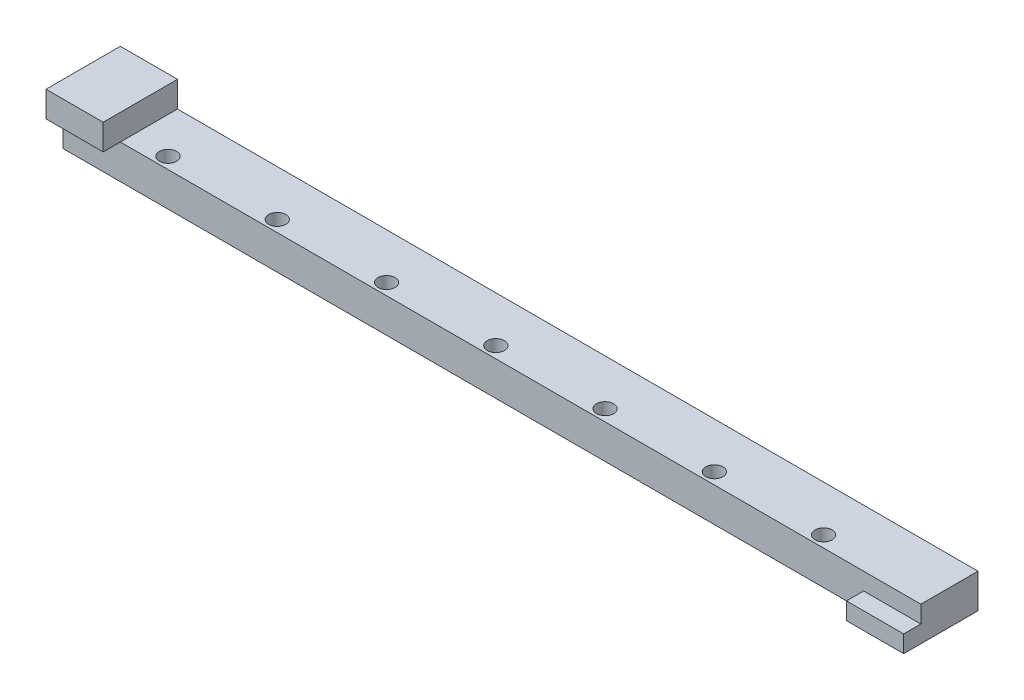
SolidWorks part; units mm, degrees
ref_plane "Front Plane" through (0, 0, 0) normal (0, 0, 1) x (1, 0, 0)
ref_plane "Top Plane" through (0, 0, 0) normal (0, 1, 0) x (1, 0, 0)
ref_plane "Right Plane" through (0, 0, 0) normal (1, 0, 0) x (0, 0, -1)
sketch "Sketch1" plane through (0, 0, 0) normal (0, 1, 0) x (1, 0, 0)
  line L0 (0, 0) -> (150, 0)
  line L1 (150, 0) -> (150, 10)
  line L2 (150, 10) -> (0, 10)
  line L3 (0, 10) -> (0, 0)
extrude "Boss-Extrude1" add sketch "Sketch1" along normal blind 6
sketch "Sketch2" plane through (0, 0, 0) normal (0, 0, 1) x (1, 0, 0)
  line L1 (150, 0) -> (140, 0)
  line L2 (0, 0) -> (150, 0) construction
  line L6 (150, 3) -> (140, 3)
  line L7 (150, 0) -> (150, 3)
  line L8 (140, 3) -> (140, 0)
extrude "Boss-Extrude2" add sketch "Sketch2" along normal blind 3
sketch "Sketch3" plane through (0, 6, 0) normal (0, 1, 0) x (1, 0, 0)
  line L0 (150, 0) -> (140, 0) construction
  line L1 (0, 0) -> (150, 0) construction
  line L2 (131, 0) -> (131, 2) construction
  line L3 (131, 2) -> (111.89, 2) construction
  line L4 (111.89, 2) -> (92.78, 2) construction
  line L5 (73.67, 2) -> (54.56, 2) construction
  line L6 (92.78, 2) -> (73.67, 2) construction
  line L7 (54.56, 2) -> (35.45, 2) construction
  line L8 (35.45, 2) -> (16.34, 2) construction
  line L9 (0, 0) -> (150, 0) construction
  line L10 (140, 0) -> (131, 0) construction
  circle A0 centre (131, 2) radius 1.5
  circle A1 centre (111.89, 2) radius 1.5
  circle A2 centre (92.78, 2) radius 1.5
  circle A3 centre (73.67, 2) radius 1.5
  circle A4 centre (16.34, 2) radius 1.5
  circle A5 centre (35.45, 2) radius 1.5
  circle A6 centre (54.56, 2) radius 1.5
  dimension "D1" = 19.11
  dimension "D2" = 19.11
  dimension "D3" = 19.11
  dimension "D4" = 19.11
  dimension "D5" = 19.11
  dimension "D6" = 19.11
extrude "Cut-Extrude1" cut sketch "Sketch3" against normal through all
sketch "Esquisse1" plane through (0, 6, 0) normal (0, 1, 0) x (1, 0, 0)
  line L0 (0, 10) -> (0, 0)
  line L1 (0, 0) -> (10, 0)
  line L2 (0, 0) -> (150, 0) construction
  line L3 (10, 0) -> (10, 10)
  line L4 (150, 10) -> (0, 10) construction
  line L5 (10, 10) -> (0, 10)
extrude "Boss.-Extru.1" add sketch "Esquisse1" along normal blind 4.5
sketch "Esquisse2" plane through (0, 0, 0) normal (0, 0, 1) x (1, 0, 0)
  line L0 (10, 10.5) -> (10, 6)
  line L1 (10, 6) -> (0, 6)
  line L2 (0, 10.5) -> (0, 0) construction
  line L3 (0, 6) -> (0, 10.5)
  line L4 (0, 10.5) -> (10, 10.5)
extrude "Boss.-Extru.2" add sketch "Esquisse2" along normal blind 3
